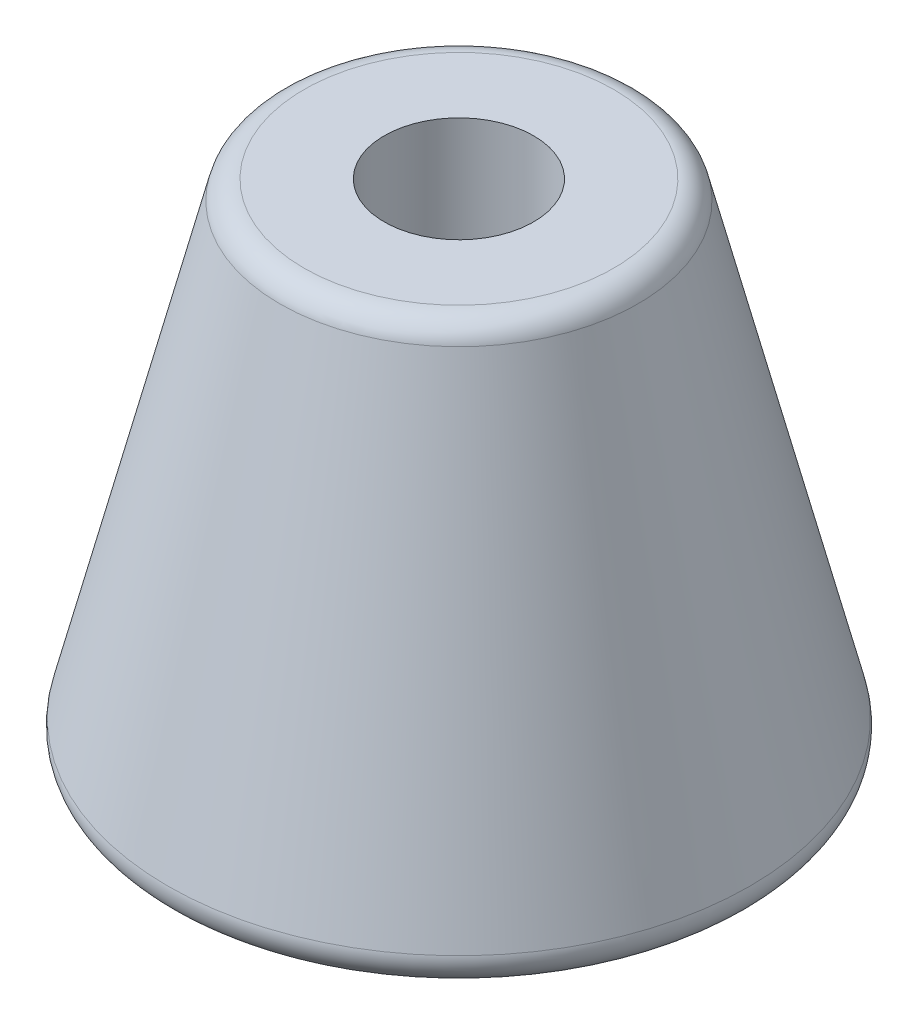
SolidWorks part; units mm, degrees
ref_plane "Piano frontale" through (0, 0, 0) normal (0, 0, 1) x (1, 0, 0)
ref_plane "Piano superiore" through (0, 0, 0) normal (0, 1, 0) x (1, 0, 0)
ref_plane "Piano destro" through (0, 0, 0) normal (1, 0, 0) x (0, 0, -1)
sketch "Schizzo1" plane through (0, 0, 0) normal (0, 0, 1) x (1, 0, 0)
  line L0 (0, 0) -> (0, 61.3224) construction
  line L1 (4, 0) -> (10.7192, 0)
  line L2 (11.6894, 1.2425) -> (7.1894, 19.2425)
  line L3 (6.2192, 20) -> (3, 20)
  line L4 (3, 1) -> (3, 20)
  line L5 (4, 0) -> (3, 1)
  arc A0 (10.7192, 0) -> (11.6894, 1.2425) centre (10.7192, 1) ccw
  arc A1 (7.1894, 19.2425) -> (6.2192, 20) centre (6.2192, 19) ccw
  point P3 (5, 0)
  point P6 (3, 0)
  point P10 (12, 0)
  point P13 (7, 20)
  dimension "D6" = 1
  dimension "D1" = 12
  dimension "D2" = 5
  dimension "D3" = 20
  dimension "D4" = 5
  dimension "D5" = 6
revolve "Rivoluzione1" add sketch "Schizzo1" angle 360 about L0
